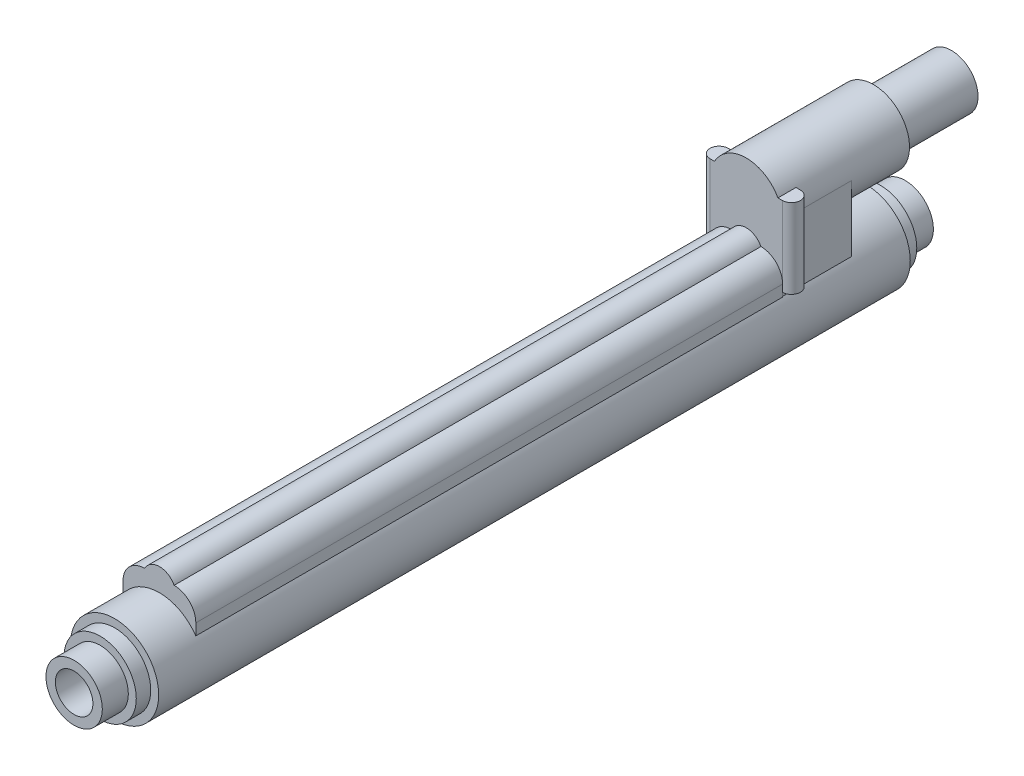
SolidWorks part; units mm, degrees
ref_plane "Plane1" through (0, 0, 0) normal (0, 0, 1) x (1, 0, 0)
ref_plane "Plane2" through (0, 0, 0) normal (0, 1, 0) x (1, 0, 0)
ref_plane "Plane3" through (0, 0, 0) normal (1, 0, 0) x (0, 0, -1)
sketch "Sketch1" plane through (0, 0, 0) normal (0, 0, 1) x (1, 0, 0)
  circle A0 centre (0, 0) radius 4.953
  dimension "D1" = 9.906
extrude "glass" add sketch "Sketch1" along normal blind 146.05
ref_plane "epoxy_start" through (0, 0, 6.858) normal (0, 0, 1) x (1, 0, 0)
sketch "Sketch3" plane through (0, 0, 6.858) normal (0, 0, 1) x (1, 0, 0)
  circle A0 centre (0, 0) radius 7.747
  dimension "D1" = 15.494
extrude "epoxy" add sketch "Sketch3" along normal blind 132.08
sketch "Sketch4" plane through (0, 0, 6.858) normal (0, 0, -1) x (-1, 0, 0)
  circle A0 centre (0, 0) radius 6.35
  dimension "D1" = 12.7
extrude "rubber1" add sketch "Sketch4" along normal blind 2.54
sketch "Sketch5" plane through (0, 0, 138.938) normal (0, 0, 1) x (1, 0, 0)
  circle A0 centre (0, 0) radius 6.35
  dimension "D1" = 12.7
extrude "rubber2" add sketch "Sketch5" along normal blind 2.54
sketch "Sketch2" plane through (0, 0, 0) normal (0, 0, -1) x (-1, 0, 0)
  circle A0 centre (0, 0) radius 3.302
  dimension "D1" = 6.604
extrude "glass_hole" cut sketch "Sketch2" against normal through all
ref_plane "Plane5" through (0, 0, 15.748) normal (0, 0, 1) x (1, 0, 0)
sketch "Sketch7" plane through (0, 0, 15.748) normal (0, 0, 1) x (1, 0, 0)
  line L0 (6.35, 16.002) -> (6.35, 4.4377)
  line L1 (0, 0) -> (0, 17.78) construction
  line L2 (-6.35, 16.002) -> (-6.35, 4.4377)
  line L3 (-6.35, 4.4377) -> (6.35, 4.4377)
  arc A1 (6.35, 16.002) -> (-6.35, 16.002) centre (0, 16.002) ccw
  circle A2 centre (0, 0) radius 7.747 construction
  dimension "D1" = 16.002
  dimension "D2" = 6.35
extrude "epoxy_header" add sketch "Sketch7" along normal blind 12.192
sketch "Sketch8" plane through (0, 0, 27.94) normal (0, 0, 1) x (1, 0, 0)
  line L0 (0, 0) -> (0, 10.16) construction
  line L2 (6.4008, 4.3642) -> (6.4008, 6.35)
  line L3 (0, 10.16) -> (0, 11.684) construction
  line L4 (-6.4008, 4.3642) -> (-6.4008, 6.35)
  line L5 (-6.4008, 4.3642) -> (6.4008, 4.3642)
  circle A0 centre (0, 0) radius 7.747 construction
  arc A1 (6.4008, 6.35) -> (2.5908, 10.16) centre (2.5908, 6.35) ccw
  arc A2 (-6.4008, 6.35) -> (-2.5908, 10.16) centre (-2.5908, 6.35) cw
  arc A3 (-2.5908, 10.16) -> (2.5908, 10.16) centre (0, 8.7984) cw
  dimension "D1" = 3.81
  dimension "D2" = 1.524
extrude "epoxy_bulge" add sketch "Sketch8" along normal blind 103.124
sketch "Sketch9" plane through (0, 0, 15.748) normal (0, 0, -1) x (-1, 0, 0)
  circle A0 centre (0, 16.002) radius 6.35
  dimension "D1" = 12.7
extrude "epoxy_rod" add sketch "Sketch9" along normal blind 10.16
sketch "Sketch10" plane through (0, 0, 5.588) normal (0, 0, -1) x (-1, 0, 0)
  circle A0 centre (0, 16.002) radius 4.6736
  dimension "D1" = 9.3472
extrude "metal_feedthru" add sketch "Sketch10" along normal blind 13.716
ref_plane "Plane6" through (0, 10.16, 0) normal (0, 1, 0) x (-1, 0, 0)
sketch "Sketch11" plane through (0, 10.16, 0) normal (0, 1, 0) x (-1, 0, 0)
  line L0 (6.35, 26.3525) -> (-6.35, 26.3525) construction
  line L1 (-6.35, 27.94) -> (-6.35, 15.748) construction
  line L2 (6.35, 27.94) -> (-6.35, 27.94) construction
  line L3 (-6.35, 27.94) -> (6.35, 27.94)
  line L4 (6.35, 24.765) -> (-6.35, 24.765)
  arc A0 (6.35, 24.765) -> (6.35, 27.94) centre (6.35, 26.3525) ccw
  arc A1 (-6.35, 27.94) -> (-6.35, 24.765) centre (-6.35, 26.3525) ccw
  dimension "D1" = 1.5875
extrude "Extrude1" add sketch "Sketch11" along normal blind 8.89 and the other way blind 5.08
